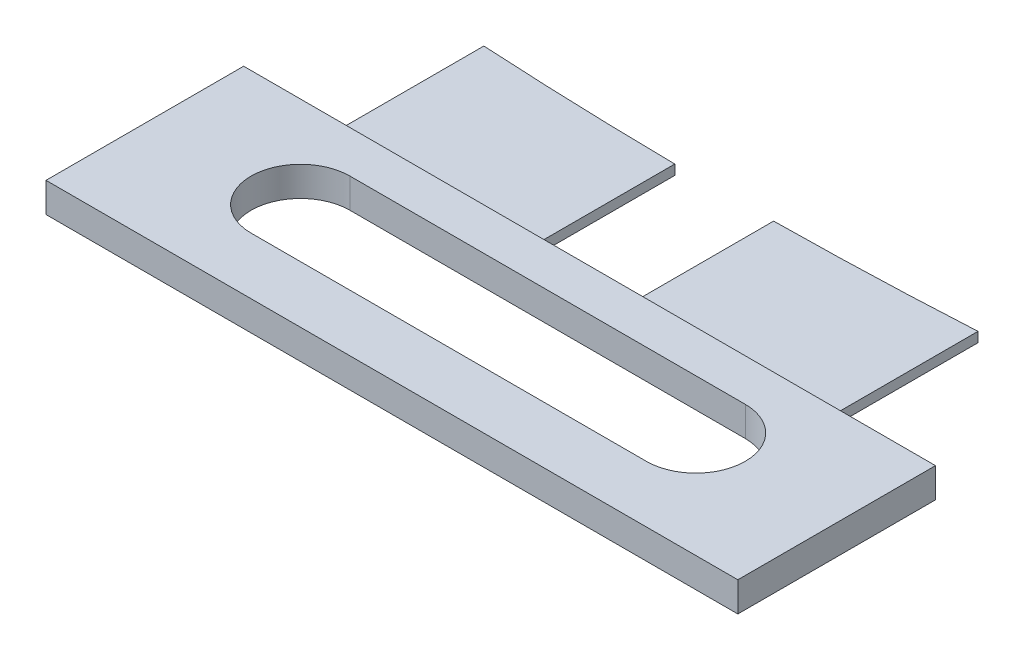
SolidWorks part; units mm, degrees
ref_plane "Front Plane" through (0, 0, 0) normal (0, 0, 1) x (1, 0, 0)
ref_plane "Top Plane" through (0, 0, 0) normal (0, 1, 0) x (1, 0, 0)
ref_plane "Right Plane" through (0, 0, 0) normal (1, 0, 0) x (0, 0, -1)
sketch "Sketch2" plane through (0, 0, 40) normal (0, 0, 1) x (1, 0, 0)
  line L1 (25, 0) -> (25, -1) construction
  line L2 (5, 0) -> (25, 0) construction
  line L3 (5, -1) -> (5, 0) construction
  line L12 (25, -1) -> (5, -1) construction
  line L13 (-5, 0) -> (-5, -1) construction
  line L14 (-25, 0) -> (-5, 0) construction
  line L15 (-25, -1) -> (-25, 0) construction
  line L16 (-5, -1) -> (-25, -1) construction
  line L17 (25, 0) -> (25, -1)
  line L18 (5, 0) -> (25, 0)
  line L19 (5, -1) -> (5, 0)
  line L20 (25, -1) -> (5, -1)
  line L21 (-5, 0) -> (-5, -1)
  line L22 (-25, 0) -> (-5, 0)
  line L23 (-25, -1) -> (-25, 0)
  line L24 (-5, -1) -> (-25, -1)
extrude "Boss-Extrude1" add sketch "Sketch2" against normal up to surface (13.6199 mm away)
sketch "Sketch3" plane through (0, 0, 40) normal (0, 0, 1) x (1, 0, 0)
  line L1 (-35, 0.3823) -> (35, 0.3823)
  line L2 (-35, 0.3823) -> (-35, -2.6177)
  line L3 (-35, -2.6177) -> (35, -2.6177)
  line L4 (35, 0.3823) -> (35, -2.6177)
  point P4 (0, -2.6177)
  dimension "D1" = 70
  dimension "D2" = 3
extrude "Boss-Extrude2" add sketch "Sketch3" along normal blind 20
sketch "Sketch4" plane through (0, 0.3823, 0) normal (0, 1, 0) x (1, 0, 0)
  line L0 (-20, -49.2497) -> (20, -49.2497) construction
  line L1 (-20, -44.2497) -> (20, -44.2497)
  line L2 (-20, -54.2497) -> (20, -54.2497)
  arc A0 (-20, -44.2497) -> (-20, -54.2497) centre (-20, -49.2497) ccw
  arc A1 (20, -54.2497) -> (20, -44.2497) centre (20, -49.2497) ccw
  point P2 (0, -49.2497)
  dimension "D1" = 40
  dimension "D2" = 10
extrude "Cut-Extrude1" cut sketch "Sketch4" against normal through all
